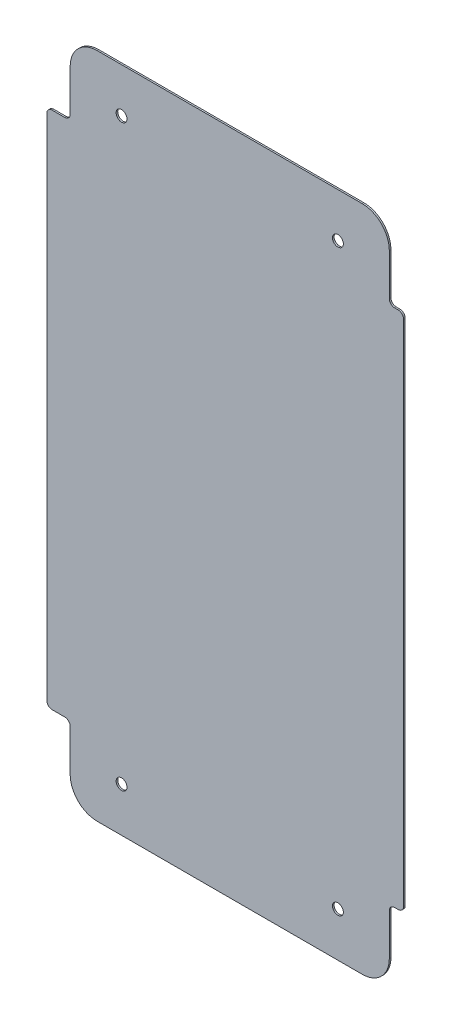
SolidWorks part; units mm, degrees
ref_plane "Front Plane" through (0, 0, 0) normal (0, 0, 1) x (1, 0, 0)
ref_plane "Top Plane" through (0, 0, 0) normal (0, 1, 0) x (1, 0, 0)
ref_plane "Right Plane" through (0, 0, 0) normal (1, 0, 0) x (0, 0, -1)
sketch "Sketch1" plane through (0, 0, 0) normal (0, 0, 1) x (1, 0, 0)
  line L0 (-74.93, 0) -> (232.6979, 0) construction
  line L1 (74.93, 144.018) -> (74.93, 121.92)
  line L2 (-74.93, 144.018) -> (-74.93, 121.92)
  line L3 (74.93, -121.92) -> (74.93, -144.018)
  line L4 (81.661, 121.92) -> (74.93, 121.92)
  line L5 (81.661, 121.92) -> (81.661, -121.92)
  line L6 (81.661, -121.92) -> (74.93, -121.92)
  line L7 (-62.23, -156.718) -> (62.23, -156.718)
  line L8 (-85.9282, 121.92) -> (-85.9282, -121.92)
  line L9 (-74.93, -121.92) -> (-85.9282, -121.92)
  line L10 (-74.93, 121.92) -> (-85.9282, 121.92)
  line L11 (-74.93, -121.92) -> (-74.93, -144.018)
  line L16 (-62.23, 156.718) -> (62.23, 156.718)
  arc A0 (-111.9516, 129.54) -> (-158.75, 64.1266) centre (0, 0) ccw construction
  arc A1 (62.23, 156.718) -> (74.93, 144.018) centre (62.23, 144.018) cw
  arc A2 (-74.93, 144.018) -> (-62.23, 156.718) centre (-62.23, 144.018) cw
  arc A11 (-74.93, -144.018) -> (-62.23, -156.718) centre (-62.23, -144.018) ccw
  arc A12 (62.23, -156.718) -> (74.93, -144.018) centre (62.23, -144.018) ccw
  point P35 (-15.1662, -170.5396)
  point P57 (80.264, 0)
  point P58 (-92.71, 0)
  dimension "D3" = 12.7
  dimension "D4" = 85.9282
  dimension "D1" = 313.436
  dimension "D2" = 243.84
  dimension "D5" = 81.661
extrude "Boss-Extrude1" add sketch "Sketch1" along normal blind 0.762
hole_wizard "#10 Clearance Hole1" positions "Sketch5" profile "Sketch4" hole size "#10" standard "ANSI Inch"
sketch "Sketch5" plane through (0, 0, 0) normal (0, 0, -1) x (-1, 0, 0)
  line L0 (0, 0) -> (0, 195.7329) construction
  line L2 (0, 0) -> (-171.1988, 0) construction
  point P2 (-50.8, 135.89)
  point P24 (50.8, 135.89)
  point P26 (50.8, -135.89)
  point P27 (-50.8, -135.89)
  dimension "D1" = 135.89
  dimension "D2" = 50.8
sketch "Sketch4" plane through (50.8, 135.89, 0) normal (1, 0, 0) x (0, 1, 0)
  line L0 (0, 0) -> (0, 0.762)
  line L1 (0, 0.762) -> (2.5527, 0.762)
  line L2 (2.5527, 0.762) -> (2.5527, 0)
  line L5 (2.5527, 0) -> (0, 0)
  line L11 (0, -6.35) -> (0, 107.95) construction
  dimension "Thru Hole Dia." = 5.1054
  dimension "Thru Hole Depth" = 0.762
fillet "Fillet1" radius 2.54 8 edges at (-85.9282, 121.92, 0.381) (-74.93, 121.92, 0.381) (-85.9282, -121.92, 0.381) (-74.93, -121.92, 0.381) (81.661, -121.92, 0.381) (74.93, -121.92, 0.381) (81.661, 121.92, 0.381) (74.93, 121.92, 0.381)
